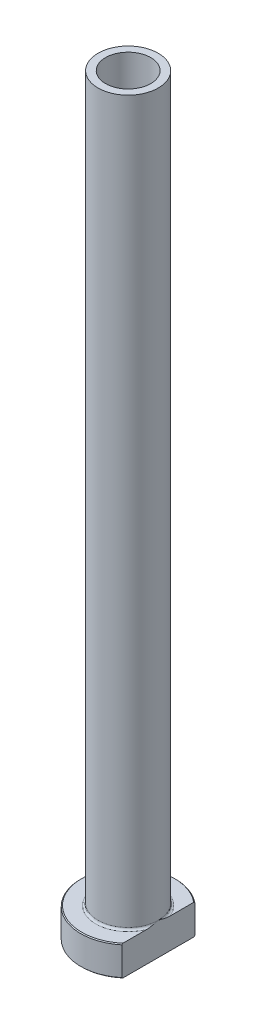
SolidWorks part; units mm, degrees
ref_plane "Front Plane" through (0, 0, 0) normal (0, 0, 1) x (1, 0, 0)
ref_plane "Top Plane" through (0, 0, 0) normal (0, 1, 0) x (1, 0, 0)
ref_plane "Right Plane" through (0, 0, 0) normal (1, 0, 0) x (0, 0, -1)
sketch "Sketch1" plane through (0, 0, 0) normal (0, 0, 1) x (1, 0, 0)
  line L0 (-5.25, 175) -> (-7, 175)
  line L1 (-7, 175) -> (-7, 7)
  line L2 (-7, 7) -> (-11, 7)
  line L3 (-11, 7) -> (-11, 0)
  line L4 (9.9, 0) -> (-9.9, 0) construction
  line L5 (-11, 0) -> (-5.5, 0)
  line L6 (-5.25, 120) -> (-5.25, 175)
  line L7 (0, 92.1877) -> (0, -15.5353) construction
  line L8 (0, -12.1) -> (0, 12.1) construction
  line L9 (-5.25, 120) -> (-5.5, 108)
  line L10 (-5.5, 108) -> (-5.5, 0)
  dimension "D1" = 0.25
  dimension "ID" = 10.5
  dimension "OD" = 14
  dimension "L" = 175
  dimension "H" = 22
  dimension "T" = 7
  dimension "N" = 55
  dimension "D2" = 12
  dimension "L-N" = 120
revolve "Revolve1" add sketch "Sketch1" angle 360 about L7
fillet "Fillet1" radius 0.5 1 edges at (0, 7, 7)
chamfer "Chamfer1" distance 0.2 angle 45 2 edges at (0, 7, 11) (0, 0, 11)
sketch "Sketch2" plane through (0, 0, 0) normal (0, -1, 0) x (1, 0, 0)
  line L0 (7, 8.4853) -> (7, -8.4853)
  circle A0 centre (0, 0) radius 11 construction
  arc A1 (7, 8.4853) -> (7, -8.4853) centre (0, 0) cw
  circle A2 centre (0, 0) radius 7 construction
extrude "Cut-Extrude1" cut sketch "Sketch2" against normal through all
chamfer "Chamfer2" distance 0.5 angle 45 1 edges at (0, 0, 5.5)
